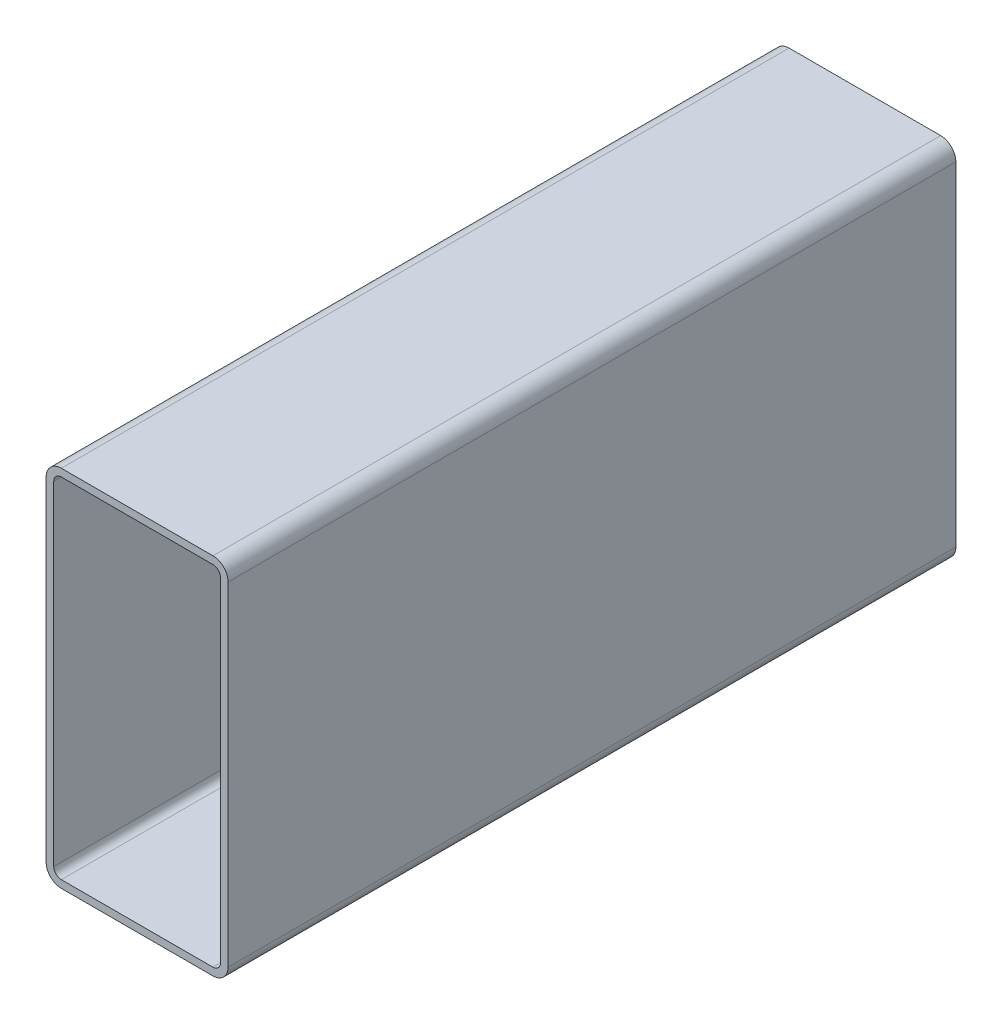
SolidWorks part; units mm, degrees
ref_plane "Front Plane" through (0, 0, 0) normal (0, 0, 1) x (1, 0, 0)
ref_plane "Top Plane" through (0, 0, 0) normal (0, 1, 0) x (1, 0, 0)
ref_plane "Right Plane" through (0, 0, 0) normal (1, 0, 0) x (0, 0, -1)
sketch "Sketch1" plane through (0, 0, 0) normal (0, 0, 1) x (1, 0, 0)
sketch_block_instance "HSS6x3x0.125-1"
sketch_block "HSS6x3x0.125"
extrude "Boss-Extrude1" add sketch "Sketch1" along normal blind 304.8
